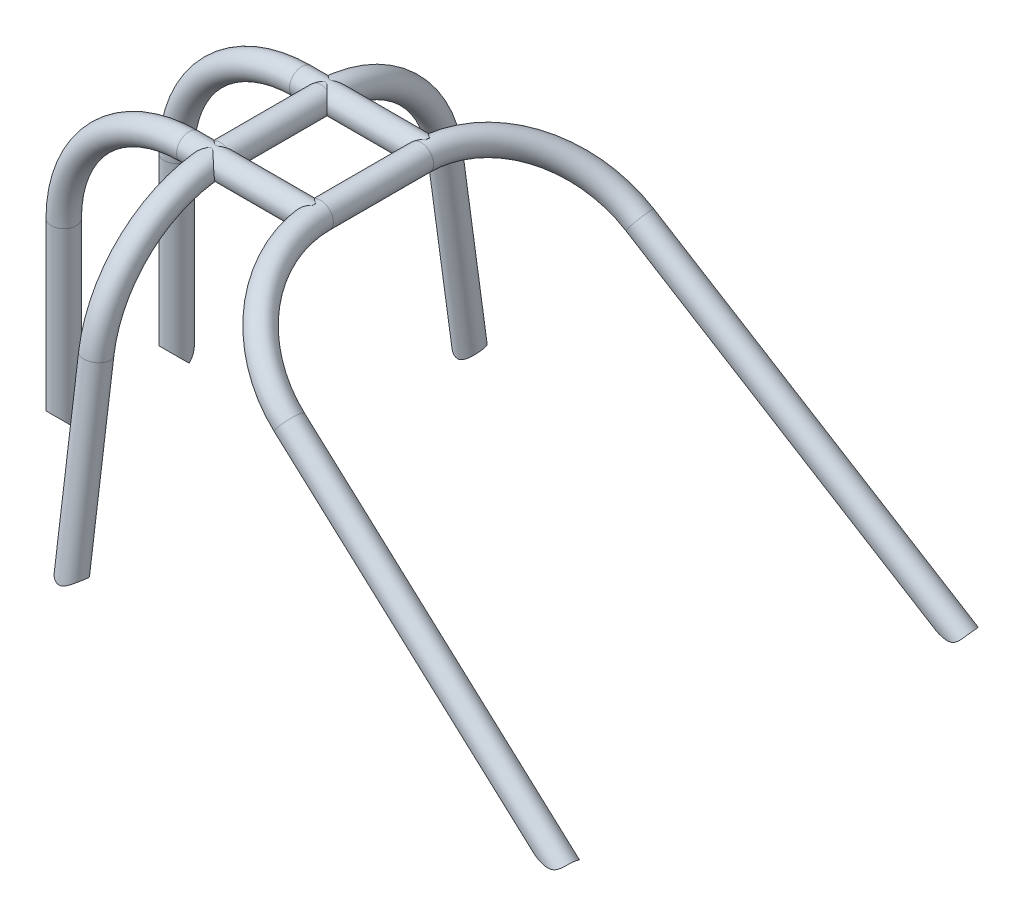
SolidWorks part; units mm, degrees
ref_plane "Front Plane" through (0, 0, 0) normal (0, 0, 1) x (1, 0, 0)
ref_plane "Top Plane" through (0, 0, 0) normal (0, 1, 0) x (1, 0, 0)
ref_plane "Right Plane" through (0, 0, 0) normal (1, 0, 0) x (0, 0, -1)
sketch "Sketch1" plane through (0, 0, 0) normal (0, 0, 1) x (1, 0, 0)
  line L0 (0, 0) -> (330.2, 0)
  line L1 (0, 0) -> (0, 88.9)
  line L2 (76.2, 152.4) -> (127, 152.4)
  line L3 (127, 152.4) -> (330.2, 0)
  line L4 (76.2, 152.4) -> (76.2, 0)
  line L5 (76.2, 152.4) -> (63.5, 152.4)
  arc A1 (63.5, 152.4) -> (0, 88.9) centre (63.5, 88.9) ccw
  dimension "D1" = 63.5
  dimension "D2" = 152.4
  dimension "D3" = 330.2
  dimension "D4" = 50.8
  dimension "D6" = 76.2
ref_plane "Plane1" through (0, 0, 28.575) normal (0, 0, 1) x (1, 0, 0)
ref_plane "Plane2" through (0, 0, -28.575) normal (0, 0, 1) x (1, 0, 0)
ref_plane "Plane3" through (76.2, 0, 0) normal (1, 0, 0) x (0, 0, -1)
sketch "Sk-plane-line" plane through (0, 0, 0) normal (0, 1, 0) x (1, 0, 0)
  line L0 (330.2, 0) -> (330.2, -76.6951) construction
ref_plane "Plane4" through (118.872, 158.496, 0) normal (-0.6, -0.8, 0) x (-0.8, 0.6, 0)
sketch "Sketch3" plane through (118.872, 158.496, 0) normal (-0.6, -0.8, 0) x (-0.8, 0.6, 0)
  line L0 (-264.16, -101.6) -> (-69.4817, -88.7624)
  line L1 (-10.16, -25.4) -> (-10.16, 25.4)
  line L2 (-69.4817, 88.7624) -> (-264.16, 101.6)
  line L3 (-264.16, 0) -> (0, 0) construction
  arc A0 (-69.4817, -88.7624) -> (-10.16, -25.4) centre (-73.66, -25.4) ccw
  arc A1 (-10.16, 25.4) -> (-69.4817, 88.7624) centre (-73.66, 25.4) ccw
  dimension "D1" = 63.5
  dimension "D2" = 203.2
  dimension "D3" = 50.8
ref_plane "Pl-prof_fr-hoop" through (330.2, 0, 101.6) normal (-0.7983, 0.5987, -0.0658) x (-0.0491, 0.0442, 0.9978)
sketch "Sketch4" plane through (330.2, 0, 101.6) normal (-0.7983, 0.5987, -0.0658) x (-0.0491, 0.0442, 0.9978)
  circle A0 centre (0, 0) radius 6.35
  dimension "D1" = 12.7
sweep "Sweep-Thin1" add profiles "Sketch4" path "Sketch3" parameters "D1"=1.651
sketch "Sketch5" plane through (76.2, 0, 0) normal (1, 0, 0) x (0, 0, -1)
  line L0 (-101.6, 0) -> (-88.3186, 97.4731)
  line L1 (-25.4, 152.4) -> (25.4, 152.4)
  line L2 (88.3186, 97.4731) -> (101.6, 0)
  line L3 (0, 0) -> (0, -30.7488) construction
  arc A0 (-88.3186, 97.4731) -> (-25.4, 152.4) centre (-25.4, 88.9) cw
  arc A1 (25.4, 152.4) -> (88.3186, 97.4731) centre (25.4, 88.9) cw
  dimension "D1" = 63.5
  dimension "D2" = 101.6
  dimension "D3" = 101.6
  dimension "D4" = 50.8
ref_plane "Plane5" through (76.2, 0, 101.6) normal (0, 0.9908, -0.135) x (1, 0, 0)
sketch "Sketch12" plane through (76.2, 0, 101.6) normal (0, 0.9908, -0.135) x (1, 0, 0)
  circle A0 centre (0, 0) radius 6.35
  dimension "D1" = 12.7
sketch "Sketch7" plane through (0, 0, 28.575) normal (0, 0, 1) x (1, 0, 0)
  line L0 (0, 0) -> (0, 88.9) construction
  line L1 (76.2, 152.4) -> (127, 152.4) construction
  line L2 (0, 0) -> (0, 88.9)
  line L3 (76.2, 152.4) -> (127, 152.4)
  line L4 (76.2, 152.4) -> (63.5, 152.4) construction
  line L5 (76.2, 152.4) -> (63.5, 152.4)
  arc A1 (63.5, 152.4) -> (0, 88.9) centre (63.5, 88.9) ccw construction
  arc A2 (63.5, 152.4) -> (0, 88.9) centre (63.5, 88.9) ccw
sketch "Sketch8" plane through (0, 0, -28.575) normal (0, 0, 1) x (1, 0, 0)
  line L0 (0, 0) -> (0, 88.9) construction
  line L1 (76.2, 152.4) -> (127, 152.4) construction
  line L2 (0, 0) -> (0, 88.9)
  line L3 (76.2, 152.4) -> (127, 152.4)
  line L4 (76.2, 152.4) -> (63.5, 152.4) construction
  line L5 (76.2, 152.4) -> (63.5, 152.4)
  arc A1 (63.5, 152.4) -> (0, 88.9) centre (63.5, 88.9) ccw construction
  arc A2 (63.5, 152.4) -> (0, 88.9) centre (63.5, 88.9) ccw
sketch "Sketch9" plane through (0, 0, 0) normal (0, 1, 0) x (1, 0, 0)
  circle A0 centre (0, 28.575) radius 6.35
  circle A1 centre (0, -28.575) radius 6.35
  dimension "D1" = 12.7
sweep "Sweep-Thin3" add profiles "Sketch9" path "Sketch7" parameters "D1"=1.651
sketch "Sketch10" plane through (0, 0, 0) normal (1, 0, 0) x (0, 0, -1)
  line L0 (0, 0) -> (0, 41.1409) construction
  circle A0 centre (-101.6, 0) radius 7.9375
  circle A1 centre (101.6, 0) radius 7.9375
  dimension "D2" = 15.875
  dimension "D1" = 203.2
sweep "Sweep-Thin4" add profiles "Sketch12" path "Sketch5" parameters "D1"=1.651
sketch "Sketch11" plane through (0, 0, 0) normal (0, 0, 1) x (1, 0, 0)
  circle A0 centre (0, 0) radius 6.35
  dimension "D1" = 12.7
extrude "Cut-Extrude2" cut sketch "Sketch11" against normal mid plane 152.4
sketch "Sketch14" plane through (0, 0, 0) normal (1, 0, 0) x (0, 0, -1)
  line L0 (0, 0) -> (0, 39.5804) construction
  circle A0 centre (101.6, 0) radius 7.9375
  circle A1 centre (-101.6, 0) radius 7.9375
  dimension "D1" = 15.875
  dimension "D2" = 203.2
extrude "Cut-Extrude4" cut sketch "Sketch14" along normal blind 381
